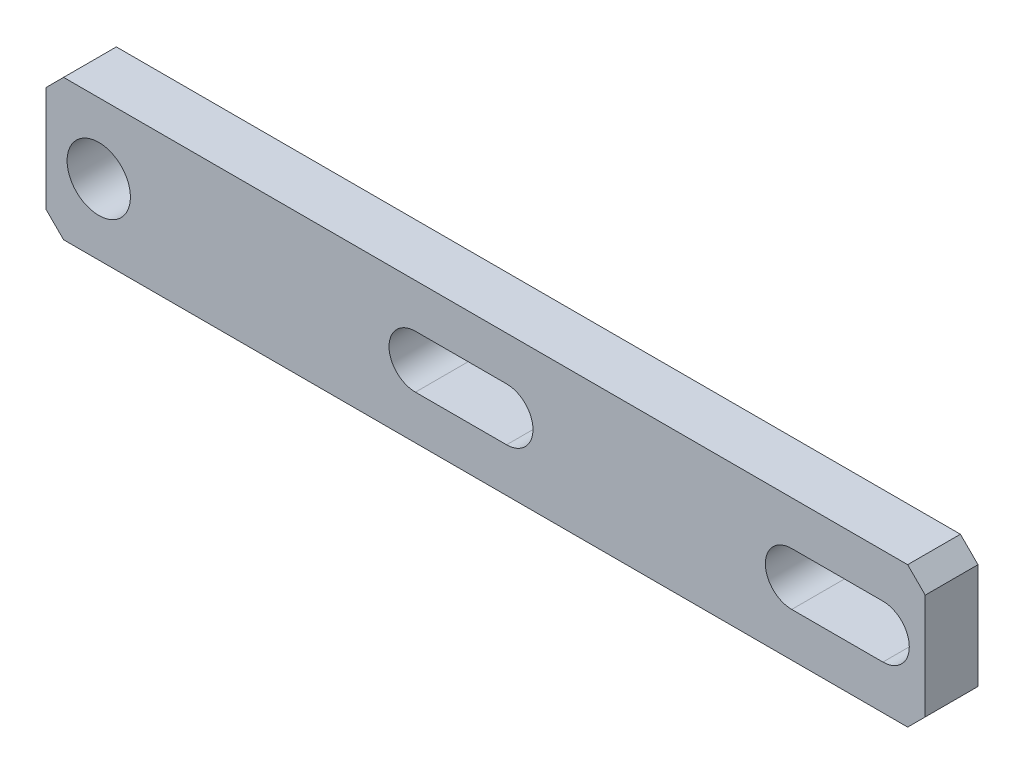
SolidWorks part; units mm, degrees
ref_plane "Ebene vorne" through (0, 0, 0) normal (0, 0, 1) x (1, 0, 0)
ref_plane "Ebene oben" through (0, 0, 0) normal (0, 1, 0) x (1, 0, 0)
ref_plane "Ebene rechts" through (0, 0, 0) normal (1, 0, 0) x (0, 0, -1)
sketch "Skizze1" plane through (0, 0, 0) normal (0, 0, 1) x (1, 0, 0)
  line L0 (0, 5) -> (0, 35)
  line L1 (5, 40) -> (245, 40)
  line L2 (250, 35) -> (250, 5)
  line L3 (245, 0) -> (5, 0)
  line L4 (245, 40) -> (250, 35)
  line L5 (250, 5) -> (245, 0)
  line L6 (0, 35) -> (5, 40)
  line L7 (5, 0) -> (0, 5)
  line L8 (237.9608, 20) -> (212.0392, 20) construction
  line L9 (237.9608, 12.5) -> (212.0392, 12.5)
  line L10 (237.9608, 27.5) -> (212.0392, 27.5)
  arc A0 (237.9608, 12.5) -> (237.9608, 27.5) centre (237.9608, 20) ccw
  arc A1 (212.0392, 27.5) -> (212.0392, 12.5) centre (212.0392, 20) ccw
  point P0 (0, 0)
  point P1 (0, 40)
  point P3 (250, 40)
  point P5 (250, 0)
  point P15 (225, 20)
  dimension "D1" = 250
  dimension "D2" = 20
  dimension "D3" = 25
  dimension "D4" = 15
  dimension "D5" = 40
extrude "Aufsatz-Linear austragen1" add sketch "Skizze1" along normal blind 15
sketch "Skizze9" plane through (0, 0, 15) normal (0, 0, 1) x (1, 0, 0)
  line L0 (130.96, 20) -> (105.04, 20) construction
  line L1 (130.96, 12.5) -> (105.04, 12.5)
  line L2 (130.96, 27.5) -> (105.04, 27.5)
  line L3 (5, 40) -> (245, 40) construction
  line L4 (250, 35) -> (250, 5) construction
  arc A0 (130.96, 12.5) -> (130.96, 27.5) centre (130.96, 20) ccw
  arc A1 (105.04, 27.5) -> (105.04, 12.5) centre (105.04, 20) ccw
  point P2 (118, 20)
  dimension "D3" = 25.92
  dimension "D1" = 20
  dimension "D2" = 15
  dimension "D4" = 132
extrude "Schnitt-Linear austragen1" cut sketch "Skizze9" against normal through all
hole_wizard "Ø18.0 (18) Durchmesser Bohrung1" positions "Skizze11" profile "Skizze12" hole size "Ø18.0" standard "DIN"
sketch "Skizze11" plane through (0, 0, 15) normal (0, 0, 1) x (1, 0, 0)
  line L0 (245, 40) -> (5, 40) construction
  line L1 (0, 35) -> (0, 5) construction
  point P0 (15, 20)
  dimension "D1" = 20
  dimension "D2" = 15
sketch "Skizze12" plane through (15, 20, 15) normal (1, 0, 0) x (0, -1, 0)
  line L0 (0, 0) -> (0, 15)
  line L1 (0, 15) -> (9, 15)
  line L2 (9, 15) -> (9, 0)
  line L5 (9, 0) -> (0, 0)
  line L11 (0, -6.35) -> (0, 107.95) construction
  dimension "Bohrerdurchmesser" = 18
  dimension "Bohrungstiefe" = 15
